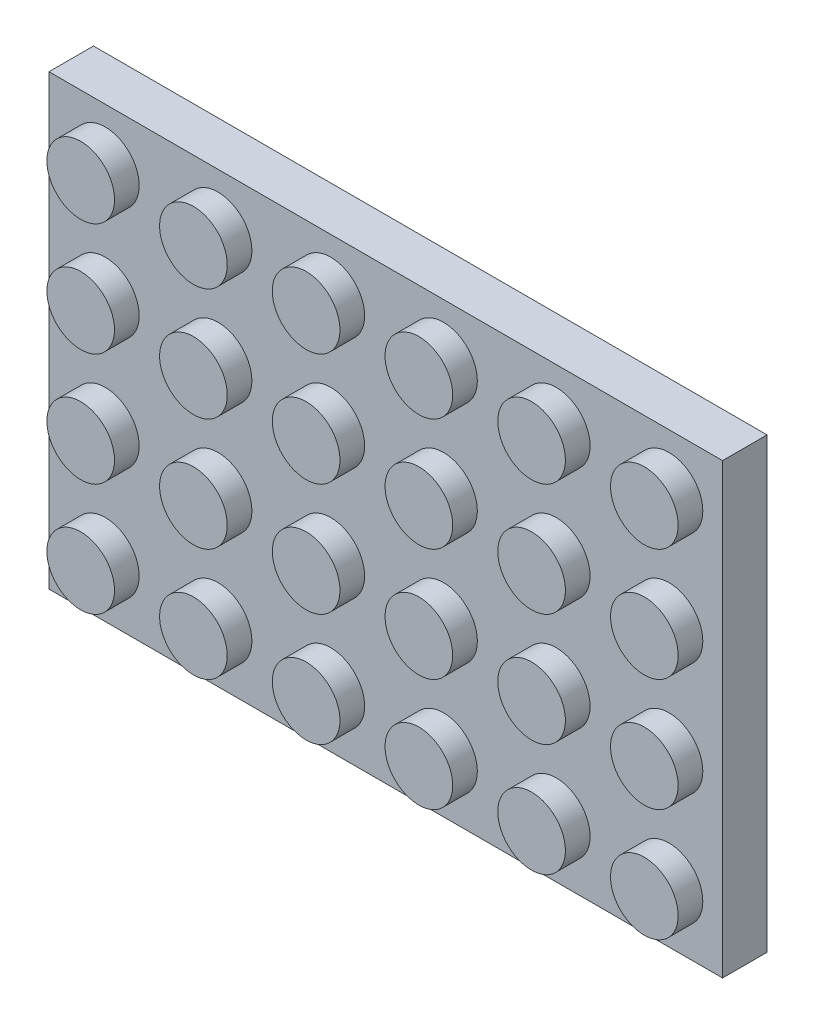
SolidWorks part; units mm, degrees
ref_plane "정면" through (0, 0, 0) normal (0, 0, 1) x (1, 0, 0)
ref_plane "윗면" through (0, 0, 0) normal (0, 1, 0) x (1, 0, 0)
ref_plane "우측면" through (0, 0, 0) normal (1, 0, 0) x (0, 0, -1)
sketch "스케치1" plane through (0.0073, -0.1313, 0) normal (0, 0, 1) x (1, 0, 0)
  line L1 (-8.5849, 7.9996) -> (39.2151, 7.9996)
  line L2 (-8.5849, 7.9996) -> (-8.5849, -23.8004)
  line L3 (-8.5849, -23.8004) -> (39.2151, -23.8004)
  line L4 (39.2151, 7.9996) -> (39.2151, -23.8004)
  dimension "D1" = 47.8
  dimension "D2" = 31.8
extrude "베이스돌출" add sketch "스케치1" against normal blind 3.16
sketch "스케치2" plane through (0, 0, 0) normal (0, 0, 1) x (1, 0, 0)
  line L0 (-8.5776, 7.8683) -> (-8.5776, -23.9317) construction
  line L1 (-8.5776, -23.9317) -> (39.2224, -23.9317) construction
  circle A0 centre (-4.5776, -19.9317) radius 2.4
  dimension "D1" = 4.8
  dimension "D2" = 4
  dimension "D3" = 4
extrude "보스-돌출1" add sketch "스케치2" along normal blind 1.75
pattern_linear "선형 패턴1" count 6 spacing 8 along (1, 0, 0) count 4 spacing 8 along (0, 1, 0) of "보스-돌출1"
sketch "스케치3" plane through (0, 0, -3.16) normal (0, 0, -1) x (-1, 0, 0)
  line L0 (8.5776, -23.9317) -> (-39.2224, -23.9317) construction
  line L1 (7.0776, -22.4317) -> (-37.7224, -22.4317)
  line L2 (7.0776, -22.4317) -> (7.0776, 6.3683)
  line L3 (7.0776, 6.3683) -> (-37.7224, 6.3683)
  line L4 (-37.7224, -22.4317) -> (-37.7224, 6.3683)
  line L5 (-39.2224, -23.9317) -> (-39.2224, 7.8683) construction
  line L6 (-39.2224, 7.8683) -> (8.5776, 7.8683) construction
  line L7 (8.5776, 7.8683) -> (8.5776, -23.9317) construction
  dimension "D1" = 1.5
  dimension "D2" = 1.5
  dimension "D3" = 1.5
  dimension "D4" = 1.5
extrude "컷-돌출1" cut sketch "스케치3" against normal blind 2
sketch "스케치4" plane through (0, 0, -1.16) normal (0, 0, -1) x (-1, 0, 0)
  line L1 (8.5776, 7.8683) -> (8.5776, -23.9317) construction
  line L2 (8.5776, -23.9317) -> (-39.2224, -23.9317) construction
  circle A0 centre (0.5776, -15.9317) radius 3.25
  circle A1 centre (0.5776, -15.9317) radius 2.5
  dimension "D1" = 8
  dimension "D2" = 8
  dimension "D3" = 5
  dimension "D4" = 6.5
extrude "보스-돌출2" add sketch "스케치4" along normal blind 2
pattern_linear "LPattern1" count 5 spacing 8 along (1, 0, 0) of "보스-돌출2"
pattern_linear "LPattern2" count 3 spacing 8 along (0, 1, 0) of "보스-돌출2", "LPattern1"
